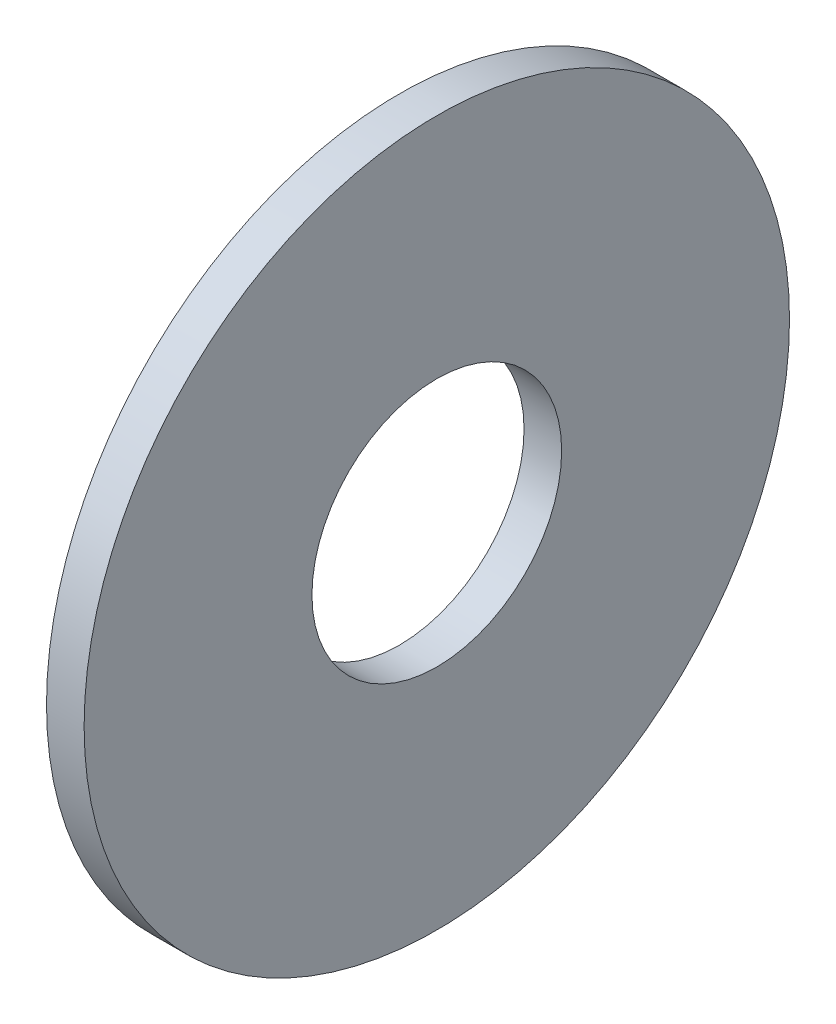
SolidWorks part; units mm, degrees
ref_plane "Plane1" through (0, 0, 0) normal (0, 0, 1) x (1, 0, 0)
ref_plane "Plane2" through (0, 0, 0) normal (0, 1, 0) x (1, 0, 0)
ref_plane "Plane3" through (0, 0, 0) normal (1, 0, 0) x (0, 0, -1)
other "Configuration Table"
sketch "Sketch1" plane through (0, 0, 0) normal (0, 0, 1) x (1, 0, 0)
  line L0 (-34.925, 0) -> (9.525, 0) construction
  line L1 (0, 13.4874) -> (0, 38.1)
  line L2 (0, 38.1) -> (-4.064, 38.1)
  line L3 (-4.064, 38.1) -> (-4.064, 13.4874)
  line L4 (-4.064, 13.4874) -> (0, 13.4874)
  dimension "Thickness" = 4.064
  dimension "Inside_dia" = 26.9748
  dimension "Outside_dia" = 76.2
revolve "Base-Revolve" add sketch "Sketch1" angle 360 about L0
